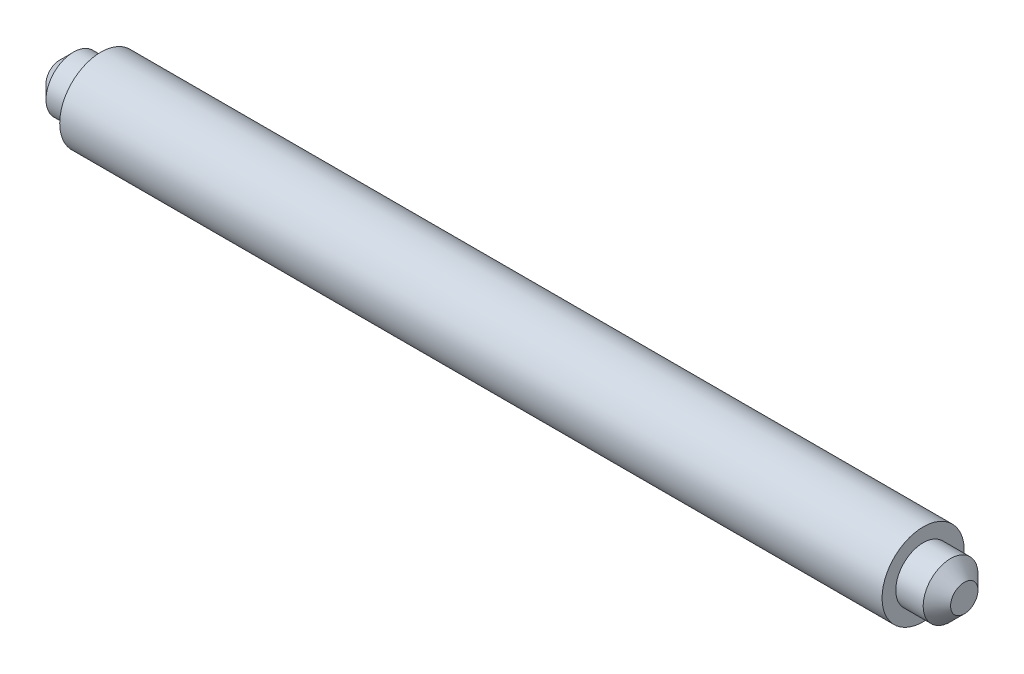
SolidWorks part; units mm, degrees
ref_plane "Plan1" through (0, 0, 0) normal (0, 0, 1) x (1, 0, 0)
ref_plane "plan2" through (0, 0, 0) normal (0, 1, 0) x (1, 0, 0)
ref_plane "Plan3" through (0, 0, 0) normal (1, 0, 0) x (0, 0, -1)
sketch "Esquisse1" plane through (0, 0, 0) normal (0, 0, 1) x (1, 0, 0)
  line L0 (-33, 2) -> (-33, 0)
  line L1 (30, 3) -> (-30, 3)
  line L2 (-30, 3) -> (-30, 2)
  line L3 (30, 3) -> (30, 2)
  line L4 (-30, 2) -> (-33, 2)
  line L5 (30, 2) -> (33, 2)
  line L6 (-33, 0) -> (33, 0)
  line L7 (33, 2) -> (33, 0)
  line L8 (-77, 0) -> (93, 0) construction
  line L9 (77, 0) -> (-93, 0) construction
  dimension "D1" = 3
  dimension "D2" = 2
  dimension "D3" = 2
  dimension "D4" = 60
  dimension "D5" = 3
  dimension "D6" = 3
revolve "Base-Révolution" add sketch "Esquisse1" angle 360 about L8
chamfer "Chanfrein1" distance 1 angle 45
